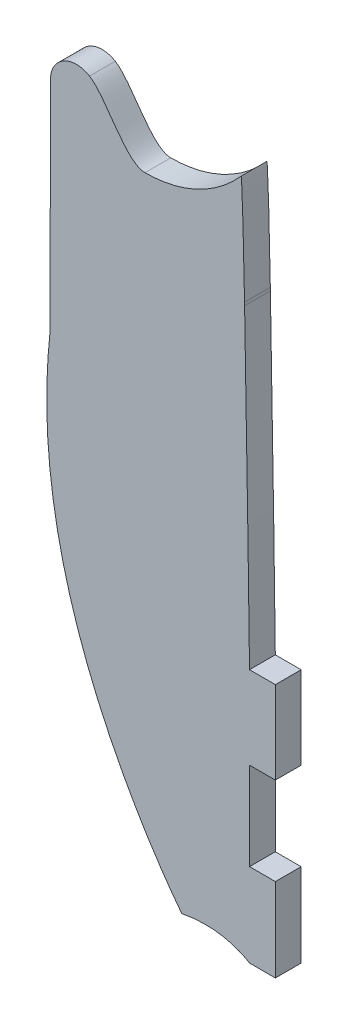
SolidWorks part; units mm, degrees
ref_plane "Alzado" through (0, 0, 0) normal (0, 0, 1) x (1, 0, 0)
ref_plane "Planta" through (0, 0, 0) normal (0, 1, 0) x (1, 0, 0)
ref_plane "Vista lateral" through (0, 0, 0) normal (1, 0, 0) x (0, 0, -1)
sketch "Croquis2" plane through (0, 0, 0) normal (0, 0, 1) x (1, 0, 0)
sketch_block_instance "F1 CAR CUT corte-1"
sketch_block "Bloque1"
extrude "Saliente-Extruir1" add sketch "Croquis2" along normal blind 3
delete or keep bodies "Sólido-Eliminar/Conservar 2" type delete bodies bodies 110 106 102 111 101 103 112 108 104 113 105 114
delete or keep bodies "Sólido-Eliminar/Conservar 4" type delete bodies bodies 109
